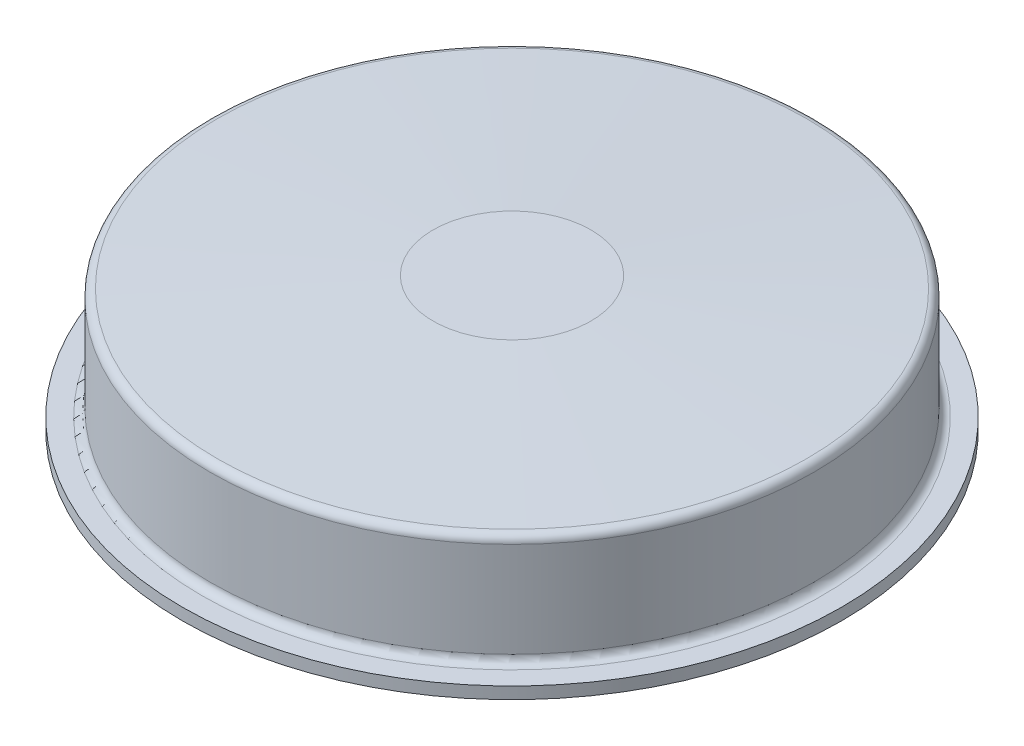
SolidWorks part; units mm, degrees
ref_plane "Ebene vorne" through (0, 0, 0) normal (0, 0, 1) x (1, 0, 0)
ref_plane "Ebene oben" through (0, 0, 0) normal (0, 1, 0) x (1, 0, 0)
ref_plane "Ebene rechts" through (0, 0, 0) normal (1, 0, 0) x (0, 0, -1)
sketch "Skizze1" plane through (0, 0, 0) normal (0, 0, 1) x (1, 0, 0)
  line L0 (600, 1187.5) -> (600, 1116.221) construction
  line L1 (675, 1187.5) -> (525, 1187.5) construction
  line L2 (600, 1187.5) -> (673.5, 1187.5)
  line L3 (673.5, 1187.5) -> (673.5, 1159.5)
  line L4 (673.5, 1159.5) -> (683.5, 1159.5)
  line L5 (600, 1187.5) -> (600, 1193.5)
  line L6 (600, 1193.5) -> (620, 1193.5)
  line L7 (620, 1193.5) -> (674.606, 1190.6006)
  line L8 (676.5, 1188.6034) -> (676.5, 1164.5)
  line L9 (678.5, 1162.5) -> (683.5, 1162.5)
  line L10 (683.5, 1162.5) -> (683.5, 1159.5)
  line L11 (676.5, 1187.5) -> (676.5, 1162.5) construction
  line L12 (676.5, 1162.5) -> (683.5, 1162.5) construction
  arc A0 (674.606, 1190.6006) -> (676.5, 1188.6034) centre (674.5, 1188.6034) cw
  arc A1 (678.5, 1162.5) -> (676.5, 1164.5) centre (678.5, 1164.5) cw
  point P16 (676.5, 1190.5)
  dimension "D8" = 2
  dimension "D1" = 10
  dimension "D2" = 1.5
  dimension "D3" = 28
  dimension "D5" = 3
  dimension "D6" = 6
  dimension "D7" = 20
  dimension "D4" = 3
revolve "Rotation1" add sketch "Skizze1" angle 360 about L0
sketch "Skizze2" plane through (0, 1162.5, 0) normal (0, 1, 0) x (1, 0, 0)
  line L0 (600, 0) -> (600, 83.5) construction
  line L1 (625.9934, 75.1455) -> (624.2938, 69.9147)
  line L2 (623.1403, 76.0725) -> (621.4407, 70.8417)
  line L3 (598.5, 79.5) -> (598.5, 74)
  line L4 (598.5, 74) -> (601.5, 74)
  line L5 (601.5, 79.5) -> (601.5, 74)
  line L6 (621.4407, 70.8417) -> (624.2938, 69.9147)
  line L7 (647.9425, 63.4352) -> (644.7096, 58.9856)
  line L8 (645.5154, 65.1985) -> (642.2826, 60.7489)
  line L9 (642.2826, 60.7489) -> (644.7096, 58.9856)
  line L10 (665.1985, 45.5154) -> (660.7489, 42.2826)
  line L11 (663.4352, 47.9425) -> (658.9856, 44.7096)
  line L12 (658.9856, 44.7096) -> (660.7489, 42.2826)
  line L13 (676.0725, 23.1403) -> (670.8417, 21.4407)
  line L14 (675.1455, 25.9934) -> (669.9147, 24.2938)
  line L15 (669.9147, 24.2938) -> (670.8417, 21.4407)
  line L16 (679.5, -1.5) -> (674, -1.5)
  line L17 (679.5, 1.5) -> (674, 1.5)
  line L18 (674, 1.5) -> (674, -1.5)
  line L19 (675.1455, -25.9934) -> (669.9147, -24.2938)
  line L20 (676.0725, -23.1403) -> (670.8417, -21.4407)
  line L21 (670.8417, -21.4407) -> (669.9147, -24.2938)
  line L22 (663.4352, -47.9425) -> (658.9856, -44.7096)
  line L23 (665.1985, -45.5154) -> (660.7489, -42.2826)
  line L24 (660.7489, -42.2826) -> (658.9856, -44.7096)
  line L25 (645.5154, -65.1985) -> (642.2826, -60.7489)
  line L26 (647.9425, -63.4352) -> (644.7096, -58.9856)
  line L27 (644.7096, -58.9856) -> (642.2826, -60.7489)
  line L28 (623.1403, -76.0725) -> (621.4407, -70.8417)
  line L29 (625.9934, -75.1455) -> (624.2938, -69.9147)
  line L30 (624.2938, -69.9147) -> (621.4407, -70.8417)
  line L31 (598.5, -79.5) -> (598.5, -74)
  line L32 (601.5, -79.5) -> (601.5, -74)
  line L33 (601.5, -74) -> (598.5, -74)
  line L34 (574.0066, -75.1455) -> (575.7062, -69.9147)
  line L35 (576.8597, -76.0725) -> (578.5593, -70.8417)
  line L36 (578.5593, -70.8417) -> (575.7062, -69.9147)
  line L37 (552.0575, -63.4352) -> (555.2904, -58.9856)
  line L38 (554.4846, -65.1985) -> (557.7174, -60.7489)
  line L39 (557.7174, -60.7489) -> (555.2904, -58.9856)
  line L40 (534.8015, -45.5154) -> (539.2511, -42.2826)
  line L41 (536.5648, -47.9425) -> (541.0144, -44.7096)
  line L42 (541.0144, -44.7096) -> (539.2511, -42.2826)
  line L43 (523.9275, -23.1403) -> (529.1583, -21.4407)
  line L44 (524.8545, -25.9934) -> (530.0853, -24.2938)
  line L45 (530.0853, -24.2938) -> (529.1583, -21.4407)
  line L46 (520.5, 1.5) -> (526, 1.5)
  line L47 (520.5, -1.5) -> (526, -1.5)
  line L48 (526, -1.5) -> (526, 1.5)
  line L49 (524.8545, 25.9934) -> (530.0853, 24.2938)
  line L50 (523.9275, 23.1403) -> (529.1583, 21.4407)
  line L51 (529.1583, 21.4407) -> (530.0853, 24.2938)
  line L52 (536.5648, 47.9425) -> (541.0144, 44.7096)
  line L53 (534.8015, 45.5154) -> (539.2511, 42.2826)
  line L54 (539.2511, 42.2826) -> (541.0144, 44.7096)
  line L55 (554.4846, 65.1985) -> (557.7174, 60.7489)
  line L56 (552.0575, 63.4352) -> (555.2904, 58.9856)
  line L57 (555.2904, 58.9856) -> (557.7174, 60.7489)
  line L58 (576.8597, 76.0725) -> (578.5593, 70.8417)
  line L59 (574.0066, 75.1455) -> (575.7062, 69.9147)
  line L60 (575.7062, 69.9147) -> (578.5593, 70.8417)
  line L61 (600, 0) -> (679.5, 0) construction
  line L62 (600, 0) -> (624.5669, 75.609) construction
  circle A0 centre (600, 0) radius 83.5 construction
  circle A1 centre (600, 0) radius 76.5 construction
  arc A2 (598.5, 79.5) -> (601.5, 79.5) centre (600, 79.5) cw
  arc A3 (623.1403, 76.0725) -> (625.9934, 75.1455) centre (624.5669, 75.609) cw
  arc A4 (645.5154, 65.1985) -> (647.9425, 63.4352) centre (646.7289, 64.3169) cw
  arc A5 (663.4352, 47.9425) -> (665.1985, 45.5154) centre (664.3169, 46.7289) cw
  arc A6 (675.1455, 25.9934) -> (676.0725, 23.1403) centre (675.609, 24.5669) cw
  arc A7 (679.5, 1.5) -> (679.5, -1.5) centre (679.5, 0) cw
  arc A8 (676.0725, -23.1403) -> (675.1455, -25.9934) centre (675.609, -24.5669) cw
  arc A9 (665.1985, -45.5154) -> (663.4352, -47.9425) centre (664.3169, -46.7289) cw
  arc A10 (647.9425, -63.4352) -> (645.5154, -65.1985) centre (646.7289, -64.3169) cw
  arc A11 (625.9934, -75.1455) -> (623.1403, -76.0725) centre (624.5669, -75.609) cw
  arc A12 (601.5, -79.5) -> (598.5, -79.5) centre (600, -79.5) cw
  arc A13 (576.8597, -76.0725) -> (574.0066, -75.1455) centre (575.4331, -75.609) cw
  arc A14 (554.4846, -65.1985) -> (552.0575, -63.4352) centre (553.2711, -64.3169) cw
  arc A15 (536.5648, -47.9425) -> (534.8015, -45.5154) centre (535.6831, -46.7289) cw
  arc A16 (524.8545, -25.9934) -> (523.9275, -23.1403) centre (524.391, -24.5669) cw
  arc A17 (520.5, -1.5) -> (520.5, 1.5) centre (520.5, 0) cw
  arc A18 (523.9275, 23.1403) -> (524.8545, 25.9934) centre (524.391, 24.5669) cw
  arc A19 (534.8015, 45.5154) -> (536.5648, 47.9425) centre (535.6831, 46.7289) cw
  arc A20 (552.0575, 63.4352) -> (554.4846, 65.1985) centre (553.2711, 64.3169) cw
  arc A21 (574.0066, 75.1455) -> (576.8597, 76.0725) centre (575.4331, 75.609) cw
  dimension "D1" = 2.5
  dimension "D2" = 2.5
  dimension "D3" = 3
  dimension "D4" = 18
extrude "Linear austragen1" [suppressed] add sketch "Skizze2" along normal up to surface (27.84 mm away)
fillet "Verrundung1" [suppressed] radius 1
